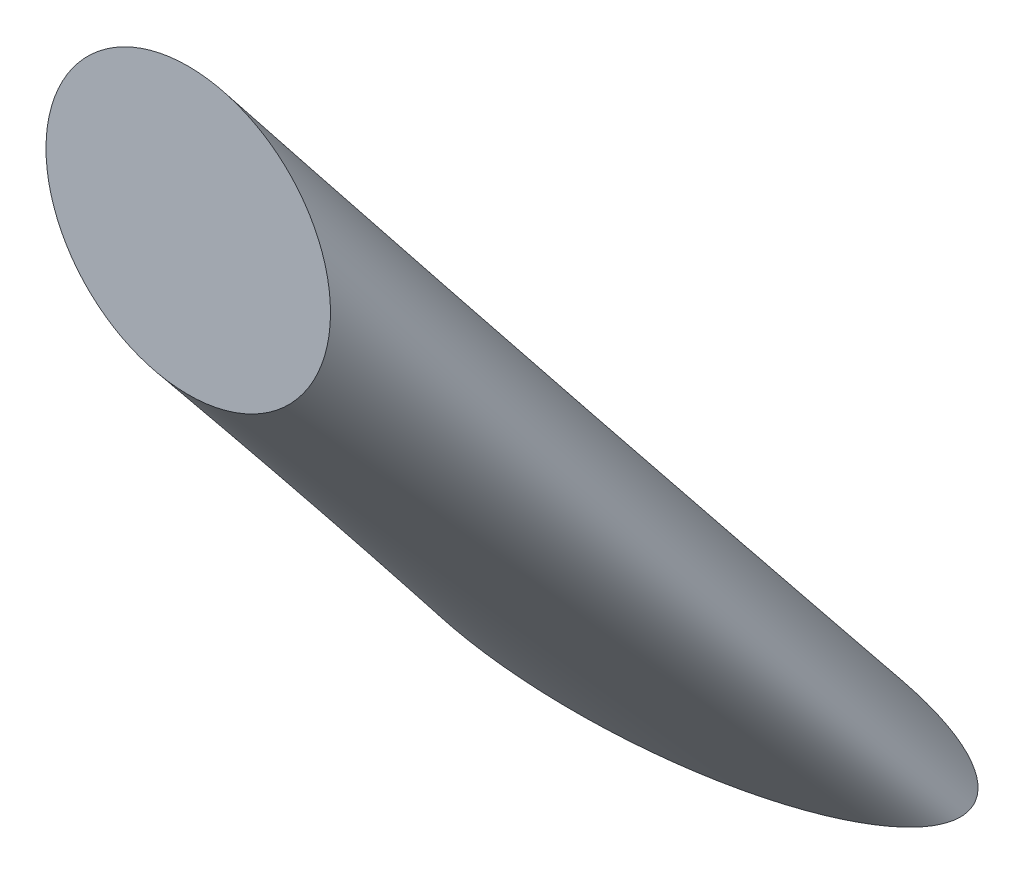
SolidWorks part; units mm, degrees
ref_plane "Front Plane" through (0, 0, 0) normal (0, 0, 1) x (1, 0, 0)
ref_plane "Top Plane" through (0, 0, 0) normal (0, 1, 0) x (1, 0, 0)
ref_plane "Right Plane" through (0, 0, 0) normal (1, 0, 0) x (0, 0, -1)
ref_plane "Plane1" through (0, 0, 120) normal (0, 0, 1) x (1, 0, 0)
sketch "Sketch2" plane through (0, 0, 120) normal (0, 0, 1) x (1, 0, 0)
  line L0 (0, 150) -> (0, 0) construction
  circle A0 centre (0, 150) radius 35
  dimension "D1" = 70
  dimension "D2" = 150
sketch "Sketch3" plane through (0, 0, 0) normal (0, 1, 0) x (1, 0, 0)
  ellipse E0 centre (0, 0) end of major axis (70, 0) minor radius 25
  dimension "D1" = 25
  dimension "D2" = 70
sketch "Sketch4" plane through (0, 0, 0) normal (1, 0, 0) x (0, 0, -1)
  line L0 (0, 0) -> (-91.4205, 72.5717) construction
  line L1 (0, 0) -> (-76.6297, 0) construction
loft "Loft3" add profiles "Sketch2", "Sketch3"
